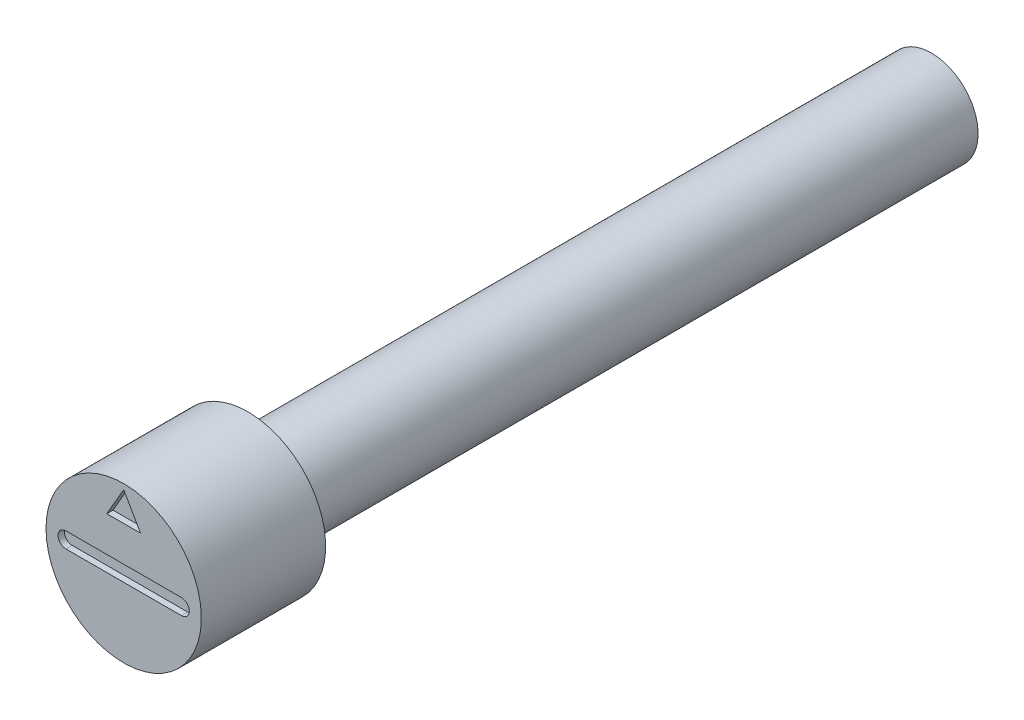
SolidWorks part; units mm, degrees
ref_plane "Front Plane" through (0, 0, 0) normal (0, 0, 1) x (1, 0, 0)
ref_plane "Top Plane" through (0, 0, 0) normal (0, 1, 0) x (1, 0, 0)
ref_plane "Right Plane" through (0, 0, 0) normal (1, 0, 0) x (0, 0, -1)
imported_body "Imported1"
other "DeleteFace1"
sketch "Sketch1" plane through (0, 0, 0) normal (0, 0, 1) x (1, 0, 0)
  line L0 (0, 1.1642) -> (-0.2715, 0.6939)
  line L1 (-0.2715, 0.6939) -> (0.2715, 0.6939)
  line L2 (0.2715, 0.6939) -> (0, 1.1642)
  line L4 (-0.93, 0.126) -> (0.93, 0.126)
  line L6 (-0.93, -0.126) -> (0.93, -0.126)
  arc A0 (-0.93, 0.126) -> (-0.93, -0.126) centre (-0.93, 0) ccw
  arc A1 (0.93, -0.126) -> (0.93, 0.126) centre (0.93, 0) ccw
  dimension "D7" = 2.112
  dimension "D8" = 1.056
  dimension "D1" = 60
  dimension "D2" = 60
  dimension "D3" = 0.543
  dimension "D4" = 0.6939
  dimension "D5" = 0.252
  dimension "D6" = 0.126
extrude "Cut-Extrude1" cut sketch "Sketch1" against normal blind 0.1
